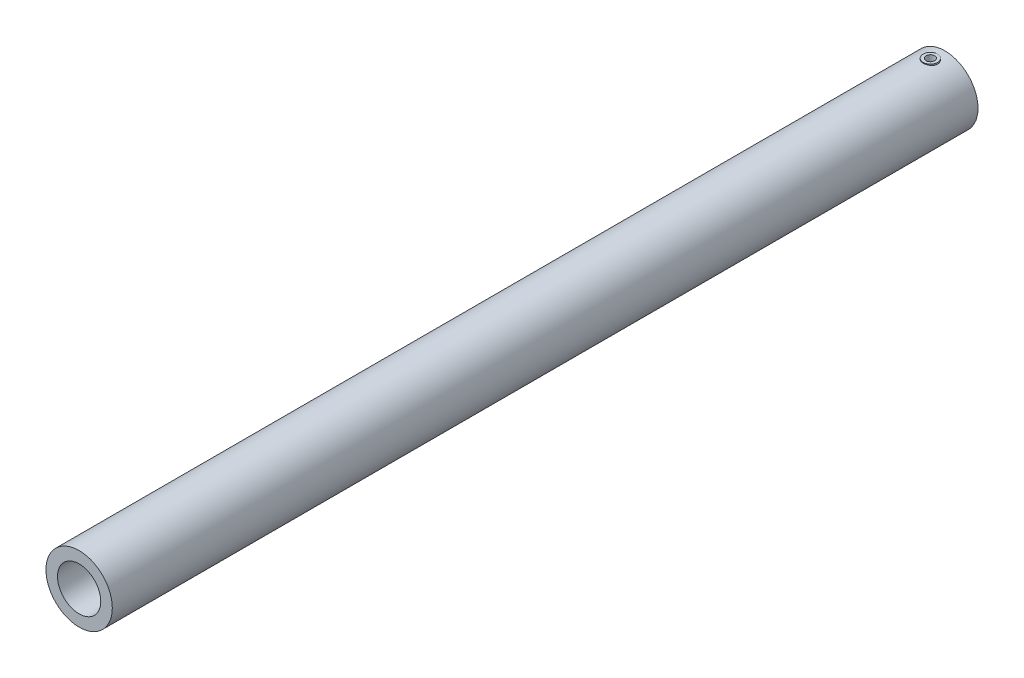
SolidWorks part; units mm, degrees
ref_plane "Plan de face" through (0, 0, 0) normal (0, 0, 1) x (1, 0, 0)
ref_plane "Plan de dessus" through (0, 0, 0) normal (0, 1, 0) x (1, 0, 0)
ref_plane "Plan de droite" through (0, 0, 0) normal (1, 0, 0) x (0, 0, -1)
sketch "Esquisse1" plane through (0, 0, 0) normal (0, 0, 1) x (1, 0, 0)
  circle A0 centre (0, 0) radius 23
  dimension "D2" = 46
extrude "Extrusion1" add sketch "Esquisse1" along normal blind 600
sketch "Esquisse3" plane through (0, 0, 600) normal (0, 0, 1) x (1, 0, 0)
  circle A0 centre (0, 0) radius 15
  dimension "D1" = 30
extrude "Enlèv. mat.-Extru.1" cut sketch "Esquisse3" against normal blind 90
ref_plane "Plan1" through (0, 23.5, 0) normal (0, 1, 0) x (-1, 0, 0)
ref_plane "Plan2" through (0, -23.5, 0) normal (0, 1, 0) x (-1, 0, 0)
sketch "Esquisse4" plane through (0, 23.5, 0) normal (0, 1, 0) x (-1, 0, 0)
  circle A0 centre (0, 10) radius 5
  dimension "D1" = 10
  dimension "D2" = 10
extrude "Extrusion2" add sketch "Esquisse4" against normal up to next
sketch "Esquisse5" plane through (0, -23.5, 0) normal (0, 1, 0) x (-1, 0, 0)
  circle A0 centre (0, 10) radius 5
extrude "Extrusion3" add sketch "Esquisse5" along normal up to next
sketch "Esquisse7" plane through (0, -23.5, 0) normal (0, -1, 0) x (1, 0, 0)
  circle A0 centre (0, 10) radius 3
  dimension "D1" = 6
extrude "Enlèv. mat.-Extru.4" cut sketch "Esquisse7" against normal blind 10
sketch "Esquisse8" plane through (0, 23.5, 0) normal (0, 1, 0) x (-1, 0, 0)
  circle A0 centre (0, 10) radius 3
  dimension "D1" = 6
extrude "Enlèv. mat.-Extru.5" cut sketch "Esquisse8" against normal blind 10
